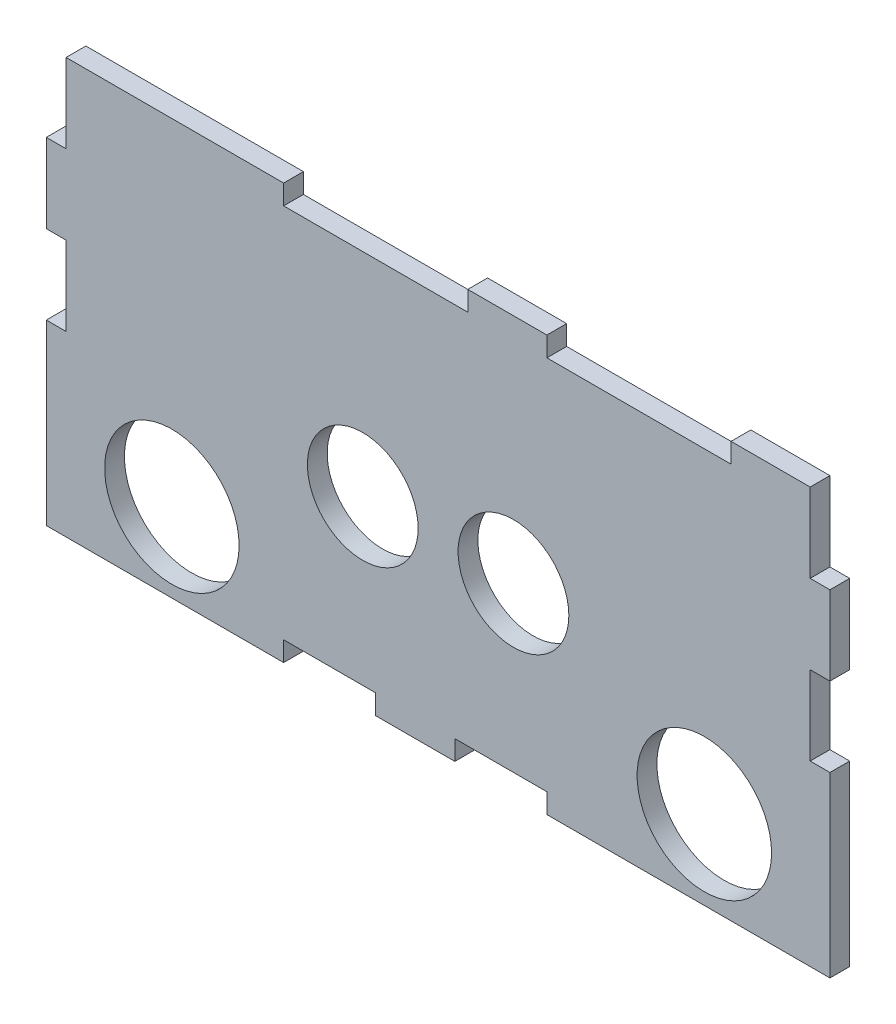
SolidWorks part; units mm, degrees
ref_plane "Front Plane" through (0, 0, 0) normal (0, 0, 1) x (1, 0, 0)
ref_plane "Top Plane" through (0, 0, 0) normal (0, 1, 0) x (1, 0, 0)
ref_plane "Right Plane" through (0, 0, 0) normal (1, 0, 0) x (0, 0, -1)
sketch "Sketch1" plane through (0, 0, 0) normal (0, 0, 1) x (1, 0, 0)
  line L0 (20.8422, 87.9243) -> (34.591, 74.1756) construction
  line L1 (0, 0) -> (198.12, 0) construction
  line L2 (0, 0) -> (0, 105) construction
  line L3 (0, 105) -> (198.12, 105) construction
  line L4 (198.12, 0) -> (198.12, 105) construction
  line L5 (34.591, 74.1756) -> (48.3398, 87.9243) construction
  line L6 (5, 105) -> (5, 0) construction
  line L7 (0, 0) -> (0, 45)
  line L8 (0, 45) -> (5, 45)
  line L9 (5, 45) -> (5, 65)
  line L10 (5, 65) -> (0, 65)
  line L11 (0, 65) -> (0, 85)
  line L12 (0, 85) -> (5, 85)
  line L13 (5, 85) -> (5, 105)
  line L14 (5, 105) -> (60, 105)
  line L15 (60, 105) -> (60, 100)
  line L16 (60, 100) -> (106.56, 100)
  line L17 (106.56, 100) -> (106.56, 105)
  line L18 (106.56, 105) -> (126.56, 105)
  line L19 (126.56, 105) -> (126.56, 100)
  line L20 (126.56, 100) -> (173.12, 100)
  line L21 (173.12, 100) -> (173.12, 105)
  line L22 (173.12, 105) -> (193.12, 105)
  line L23 (193.12, 105) -> (193.12, 85)
  line L24 (193.12, 85) -> (198.12, 85)
  line L25 (198.12, 85) -> (198.12, 65)
  line L26 (198.12, 65) -> (193.12, 65)
  line L27 (193.12, 65) -> (193.12, 45)
  line L28 (193.12, 45) -> (198.12, 45)
  line L29 (198.12, 45) -> (198.12, 0)
  line L30 (0, 0) -> (60, 0)
  line L31 (60, 0) -> (60, 5)
  line L32 (60, 5) -> (83.28, 5)
  line L33 (83.28, 5) -> (83.28, 0)
  line L34 (83.28, 0) -> (103.28, 0)
  line L35 (103.28, 0) -> (103.28, 5)
  line L36 (103.28, 5) -> (126.56, 5)
  line L37 (126.56, 5) -> (126.56, 0)
  line L38 (126.56, 0) -> (198.12, 0)
  circle A0 centre (31.75, 20) radius 17
  circle A1 centre (80.01, 46.3813) radius 14
  circle A2 centre (118.11, 46.3813) radius 14
  circle A3 centre (166.37, 20) radius 17
  circle A4 centre (31.75, 20) radius 55 construction
  circle A5 centre (31.75, 20) radius 31.75 construction
  circle A6 centre (166.37, 20) radius 55 construction
  circle A7 centre (166.37, 20) radius 31.75 construction
  circle A8 centre (31.75, 20) radius 54.25 construction
  circle A9 centre (34.591, 74.1756) radius 19.4437 construction
  circle A10 centre (20.8422, 87.9243) radius 3 construction
  circle A11 centre (20.8422, 60.4268) radius 3 construction
  circle A12 centre (48.3398, 60.4268) radius 3 construction
  circle A13 centre (48.3398, 87.9243) radius 3 construction
  circle A14 centre (34.591, 74.1756) radius 29.591 construction
  circle A15 centre (34.591, 74.1756) radius 13 construction
  dimension "D1" = 63.5
  dimension "D5" = 110
  dimension "D8" = 108.5
  dimension "D9" = 38.8874
  dimension "D10" = 6
  dimension "D11" = 59.182
  dimension "D21" = 26
  dimension "D23" = 28
  dimension "D24" = 34
  dimension "D3" = 38.1
  dimension "D4" = 134.62
  dimension "D6" = 198.12
  dimension "D7" = 105
  dimension "D12" = 20
  dimension "D13" = 5
  dimension "D14" = 20
  dimension "D15" = 20
  dimension "D16" = 45
  dimension "D17" = 20
  dimension "D18" = 20
  dimension "D19" = 55
  dimension "D20" = 5
  dimension "D22" = 20
extrude "Boss-Extrude1" add sketch "Sketch1" along normal blind 5
